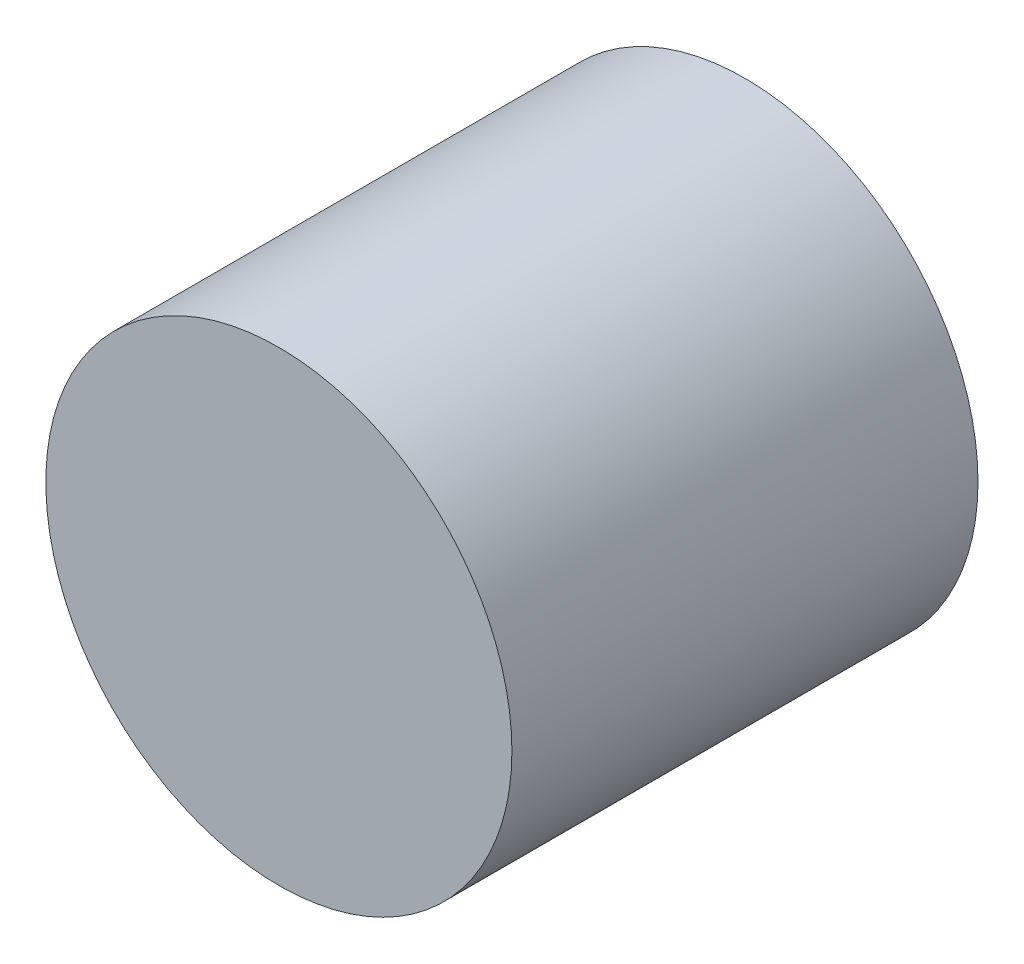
SolidWorks part; units mm, degrees
ref_plane "Front Plane" through (0, 0, 0) normal (0, 0, 1) x (1, 0, 0)
ref_plane "Top Plane" through (0, 0, 0) normal (0, 1, 0) x (1, 0, 0)
ref_plane "Right Plane" through (0, 0, 0) normal (1, 0, 0) x (0, 0, -1)
sketch "Sketch1" plane through (0, 0, 0) normal (0, 0, 1) x (1, 0, 0)
  circle A0 centre (0, 0) radius 1
  dimension "D1" = 2
extrude "Boss-Extrude1" add sketch "Sketch1" along normal blind 2
